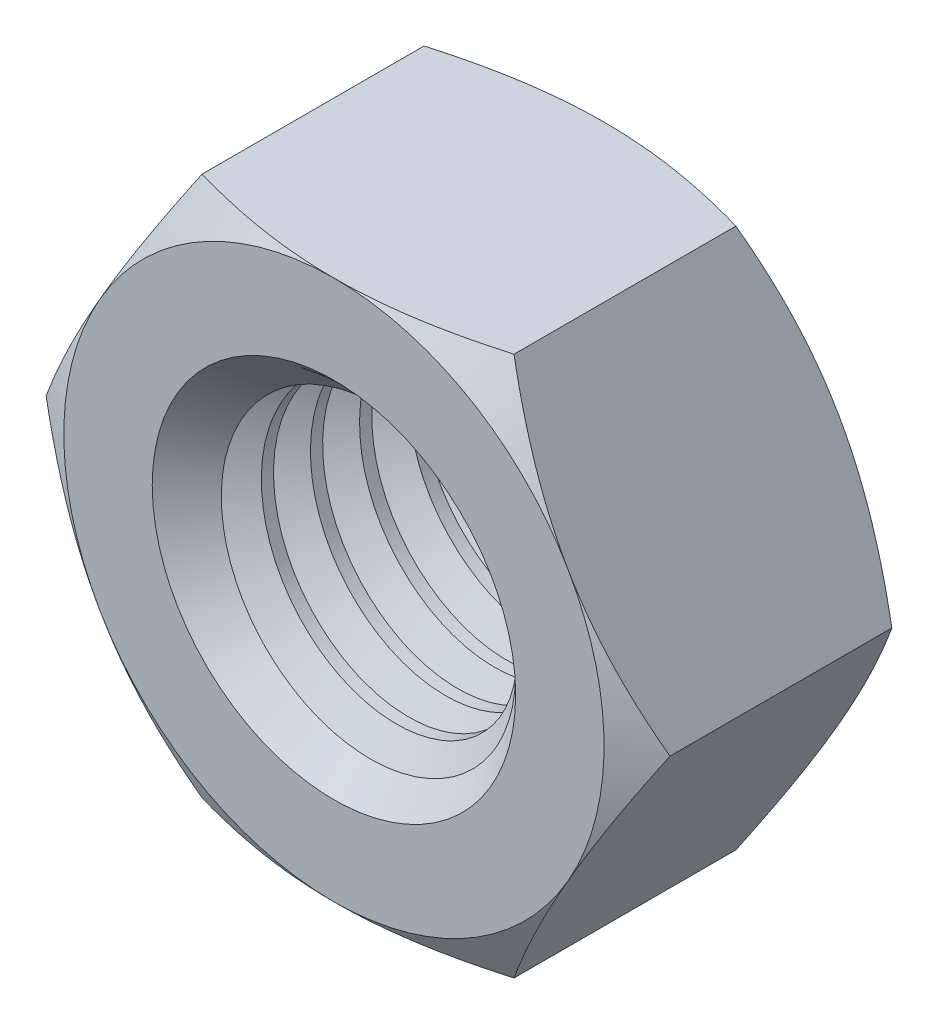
SolidWorks part; units mm, degrees
ref_plane "Front" through (0, 0, 0) normal (0, 0, 1) x (1, 0, 0)
ref_plane "Top" through (0, 0, 0) normal (0, 1, 0) x (1, 0, 0)
ref_plane "Right" through (0, 0, 0) normal (1, 0, 0) x (0, 0, -1)
sketch "Çizim1" plane through (0, 0, 0) normal (0, 0, 1) x (1, 0, 0)
  line L1 (6.3509, 0) -> (3.1754, 5.5)
  line L2 (3.1754, 5.5) -> (-3.1754, 5.5)
  line L3 (-3.1754, 5.5) -> (-6.3509, 0)
  line L4 (-6.3509, 0) -> (-3.1754, -5.5)
  line L5 (-3.1754, -5.5) -> (3.1754, -5.5)
  line L6 (3.1754, -5.5) -> (6.3509, 0)
  circle A0 centre (0, 0) radius 5.5 construction
  point P1 (0, 0)
  dimension "D1" = 11
extrude "Yükseklik-Ekstrüzyon1" add sketch "Çizim1" along normal blind 5.5
sketch "Çizim2" plane through (0, 0, 5.5) normal (0, 0, 1) x (1, 0, 0)
  circle A0 centre (0, 0) radius 5.5
extrude "Kes-Ekstrüzyon1" cut sketch "Çizim2" against normal blind 5.5 draft 60 flip side to cut
sketch "Çizim3" plane through (0, 0, 0) normal (0, 0, -1) x (-1, 0, 0)
  circle A0 centre (0, 0) radius 5.5
extrude "Kes-Ekstrüzyon2" cut sketch "Çizim3" against normal blind 5.5 draft 60 flip side to cut
sketch "Çizim4" plane through (0, 0, 0) normal (0, 0, -1) x (-1, 0, 0)
  circle A0 centre (0, 0) radius 2.85
  dimension "D1" = 5.7
extrude "Kes-Ekstrüzyon3" cut sketch "Çizim4" against normal blind 5.5
chamfer "Pah1" distance 0.85 angle 45 2 edges at (-2.85, 0, 5.5) (-2.85, 0, 0)
sketch "Çizim5" plane through (0, 0, 0) normal (0, 0, -1) x (-1, 0, 0)
  circle A0 centre (0, 0) radius 2.85
curve "Helis/Spiral1"
ref_plane "Düzlem1" through (2.85, 0, 7) normal (0, 0.9984, 0.0558) x (1, 0, 0)
sketch "Çizim6" plane through (2.85, 0, 7) normal (0, 0.9984, 0.0558) x (1, 0, 0)
  line L1 (0.65, 0) -> (-0.1898, 0.4849)
  line L3 (-0.1898, -0.4849) -> (0.65, 0)
  line L4 (-0.1898, 0.4849) -> (-0.1898, -0.4849)
  line L5 (-0.325, 0.5629) -> (-0.325, 0)
  circle A0 centre (0, 0) radius 0.325 construction
  dimension "D1" = 0.65
sweep "Kes-Süpür1" cut profiles "Çizim6" path "Helis/Spiral1"
